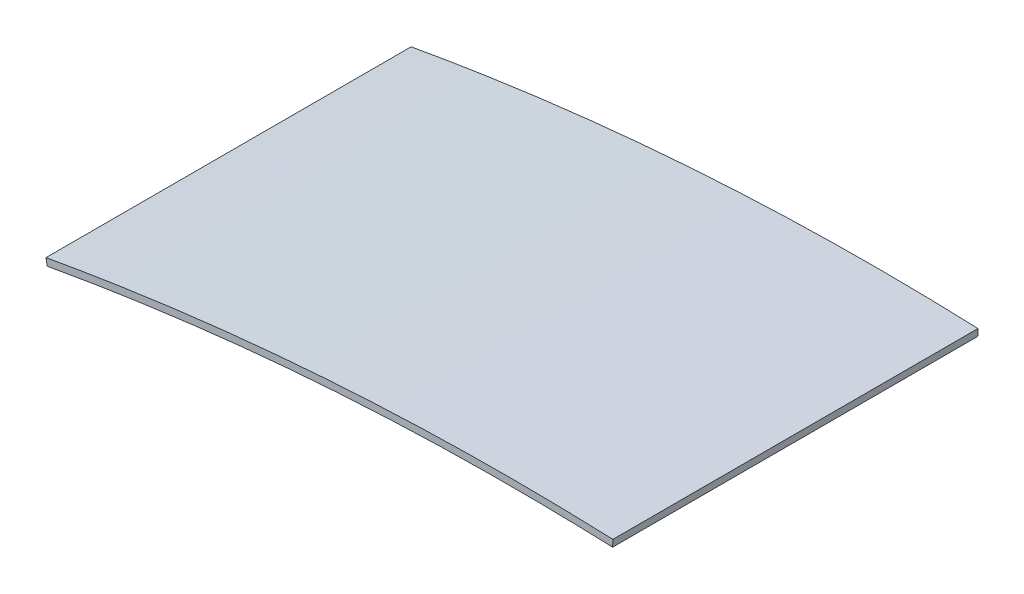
SolidWorks part; units mm, degrees
ref_plane "Front Plane" through (0, 0, 0) normal (0, 0, 1) x (1, 0, 0)
ref_plane "Top Plane" through (0, 0, 0) normal (0, 1, 0) x (1, 0, 0)
ref_plane "Right Plane" through (0, 0, 0) normal (1, 0, 0) x (0, 0, -1)
sketch "Sketch1" plane through (0, 0, 0) normal (0, 0, 1) x (1, 0, 0)
  line L0 (-55.3934, -1.1468) -> (-55.1097, -2.7214)
  line L1 (75.0322, 7.9311) -> (74.9697, 6.3323)
  spline S0 degree 3 poles (-55.3934, -1.1468) (-37.8077, 2.0217) (5.444, 7.8531) (49.0733, 8.9452) (75.0322, 7.9311) knots 0 0 0 0 0.408045 1 1 1 1
  spline S1 degree 1 poles (-55.1097, -2.7214) (74.9697, 6.3323) knots 0 0 1 1 construction
  spline S2 degree 3 poles (-55.1097, -2.7214) (-49.7434, -1.7546) (-38.976, 0.0356) (-17.4185, 3.0208) (9.6235, 5.6459) (36.7841, 6.7934) (58.5761, 6.8255) (69.5108, 6.5456) (74.9697, 6.3323) knots 0 0 0 0 0.125 0.25 0.5 0.75 0.875 1 1 1 1
  dimension "D1" = 131
  dimension "D2" = 1.6
extrude "Boss-Extrude1" add sketch "Sketch1" along normal blind 84
